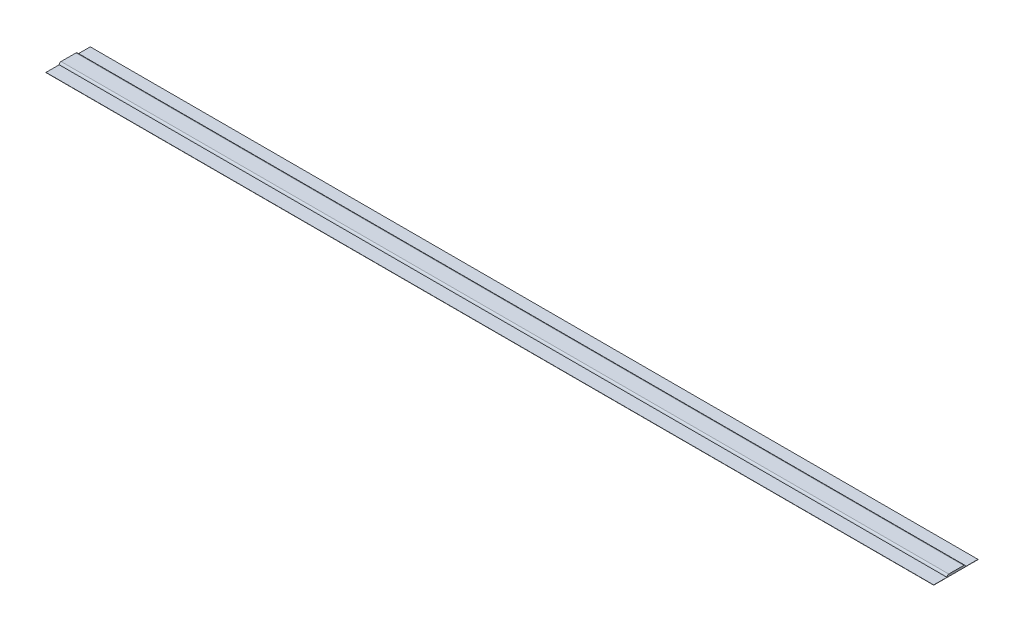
SolidWorks part; units mm, degrees
ref_plane "Front Plane" through (0, 0, 0) normal (0, 0, 1) x (1, 0, 0)
ref_plane "Top Plane" through (0, 0, 0) normal (0, 1, 0) x (1, 0, 0)
ref_plane "Right Plane" through (0, 0, 0) normal (1, 0, 0) x (0, 0, -1)
sketch "Sketch1" plane through (0, 0, 0) normal (0, 1, 0) x (1, 0, 0)
  line L1 (-477.393, 23.8125) -> (477.393, 23.8125)
  line L2 (-477.393, 23.8125) -> (-477.393, -23.8125)
  line L3 (-477.393, -23.8125) -> (477.393, -23.8125)
  line L4 (477.393, 23.8125) -> (477.393, -23.8125)
  point P4 (0, 23.8125)
  dimension "D1" = 47.625
  dimension "D2" = 23.8125
  dimension "D3" = 954.786
extrude "Boss-Extrude1" add sketch "Sketch1" along normal blind 0.254
sketch "Sketch2" plane through (477.393, 0, 0) normal (1, 0, 0) x (0, 0, -1)
  line L0 (-7.62, 0.254) -> (8.38, 0.254) construction
  line L1 (-23.8125, 0.254) -> (23.8125, 0.254) construction
  line L2 (-7.62, 2.286) -> (8.38, 2.286)
  line L3 (-7.62, -1.778) -> (8.38, -1.778)
  line L4 (-9.6467, 0.1073) -> (10.4067, 0.1073)
  arc A0 (-7.62, 2.286) -> (-7.62, -1.778) centre (-7.62, 0.254) ccw
  arc A1 (8.38, -1.778) -> (8.38, 2.286) centre (8.38, 0.254) ccw
  point P4 (0.38, 0.254)
  dimension "D1" = 2.032
  dimension "D2" = 16
  dimension "D3" = 7.62
  dimension "D4" = 0.2934
extrude "Boss-Extrude2" add sketch "Sketch2" against normal through all contours A1 L2 A0 M5
